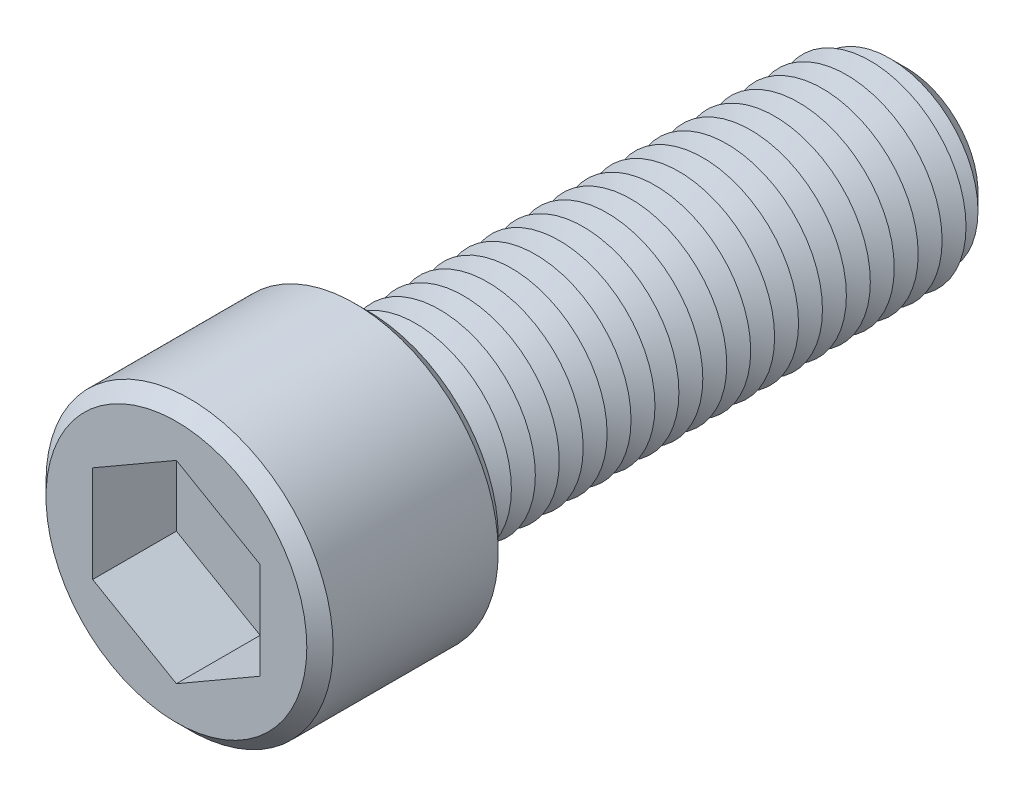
SolidWorks part; units mm, degrees
ref_plane "Front Plane" through (0, 0, 0) normal (0, 0, 1) x (1, 0, 0)
ref_plane "Top Plane" through (0, 0, 0) normal (0, 1, 0) x (1, 0, 0)
ref_plane "Right Plane" through (0, 0, 0) normal (1, 0, 0) x (0, 0, -1)
sketch "Sketch1" plane through (0, 0, 0) normal (0, 0, 1) x (1, 0, 0)
  circle A0 centre (0, 0) radius 12
  dimension "D1" = 24
extrude "Boss-Extrude1" add sketch "Sketch1" along normal blind 16
sketch "Sketch2" plane through (0, 0, 0) normal (0, 0, -1) x (-1, 0, 0)
  circle A0 centre (0, 0) radius 8
  dimension "D1" = 16
extrude "Boss-Extrude2" add sketch "Sketch2" along normal blind 45
chamfer "Chamfer1" distance 2 angle 45 1 edges at (-8, 0, -45)
sketch "Sketch3" plane through (0, 0, 0) normal (1, 0, 0) x (0, 0, -1)
  line L0 (-2.5121, 0) -> (4.5776, 0) construction
sketch "Sketch4" plane through (0, 0, 0) normal (1, 0, 0) x (0, 0, -1)
  line L0 (0, 8) -> (1, 6.2679)
  line L1 (1, 6.2679) -> (2, 8)
  line L2 (43, 8) -> (0, 8) construction
  line L3 (2, 8) -> (0, 8)
  dimension "D1" = 2
revolve "Cut-Revolve1" cut sketch "Sketch4" angle 360 about L0
pattern_linear "LPattern1" count 22 spacing 2 along (0, 0, -1) of "Cut-Revolve1"
sketch "Sketch5" plane through (0, 0, 16) normal (0, 0, 1) x (1, 0, 0)
  line L1 (0, 8.0829) -> (-7, 4.0415)
  line L2 (-7, 4.0415) -> (-7, -4.0415)
  line L3 (-7, -4.0415) -> (0, -8.0829)
  line L4 (0, -8.0829) -> (7, -4.0415)
  line L5 (7, -4.0415) -> (7, 4.0415)
  line L6 (7, 4.0415) -> (0, 8.0829)
  circle A0 centre (0, 0) radius 7 construction
  dimension "D1" = 14
extrude "Cut-Extrude1" cut sketch "Sketch5" against normal blind 7
sketch "Sketch6" plane through (0, 0, 9) normal (0, 0, 1) x (1, 0, 0)
  circle A0 centre (0, 0) radius 0.9
  dimension "D1" = 1.8
extrude "Cut-Extrude2" cut sketch "Sketch6" against normal up to surface (54 mm away)
chamfer "Chamfer2" distance 1.1 angle 45 2 edges at (12, 0, 0) (12, 0, 16)
